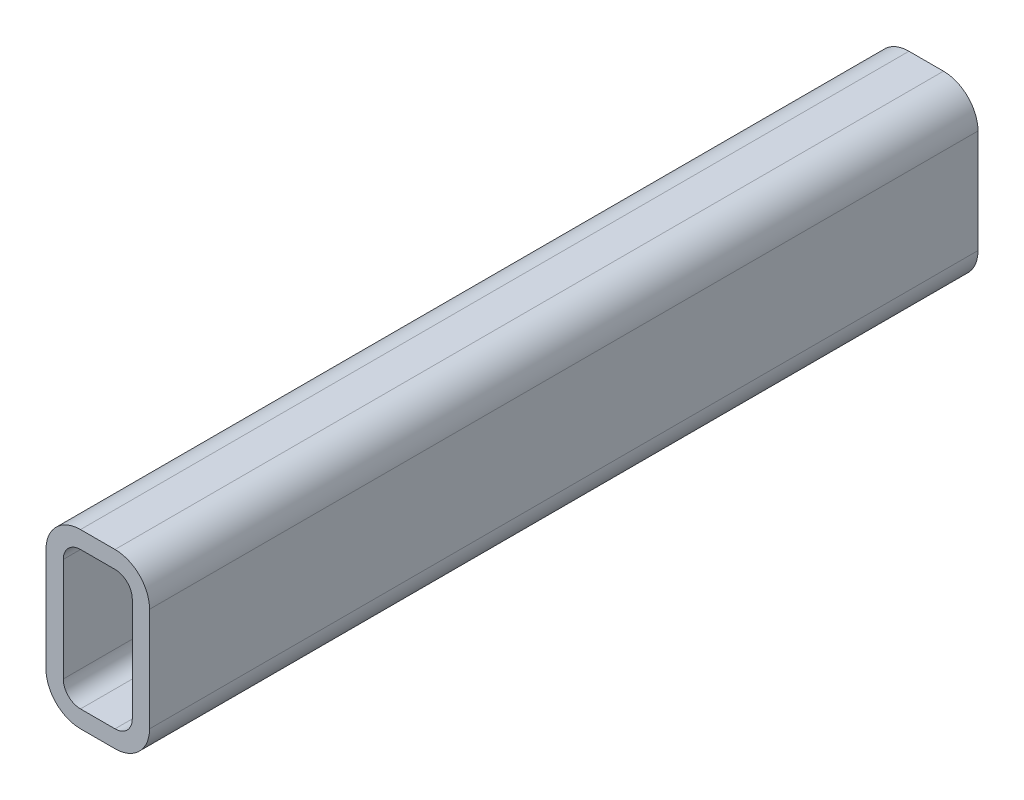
SolidWorks part; units mm, degrees
ref_plane "Front Plane" through (0, 0, 0) normal (0, 0, 1) x (1, 0, 0)
ref_plane "Top Plane" through (0, 0, 0) normal (0, 1, 0) x (1, 0, 0)
ref_plane "Right Plane" through (0, 0, 0) normal (1, 0, 0) x (0, 0, -1)
sketch "Sketch1" plane through (0, 0, 0) normal (0, 0, 1) x (1, 0, 0)
  line B0 (12.7, 63.5) -> (25.4, 63.5)
  arc B1 (38.1, 50.8) -> (25.4, 63.5) centre (25.4, 50.8) ccw
  line B2 (38.1, 50.8) -> (38.1, 12.7)
  arc B3 (25.4, 0) -> (38.1, 12.7) centre (25.4, 12.7) ccw
  line B4 (25.4, 0) -> (12.7, 0)
  arc B5 (0, 12.7) -> (12.7, 0) centre (12.7, 12.7) ccw
  line B6 (0, 12.7) -> (0, 50.8)
  arc B7 (12.7, 63.5) -> (0, 50.8) centre (12.7, 50.8) ccw
  line B8 (12.7, 57.15) -> (25.4, 57.15)
  arc B9 (31.75, 50.8) -> (25.4, 57.15) centre (25.4, 50.8) ccw
  line B10 (31.75, 50.8) -> (31.75, 12.7)
  arc B11 (25.4, 6.35) -> (31.75, 12.7) centre (25.4, 12.7) ccw
  line B12 (25.4, 6.35) -> (12.7, 6.35)
  arc B13 (6.35, 12.7) -> (12.7, 6.35) centre (12.7, 12.7) ccw
  line B14 (6.35, 12.7) -> (6.35, 50.8)
  arc B15 (12.7, 57.15) -> (6.35, 50.8) centre (12.7, 50.8) ccw
sketch_block_instance "HSS2.5x1.5x0.250-1"
sketch_block "HSS2.5x1.5x0.250"
extrude "Boss-Extrude1" add sketch "Sketch1" along normal blind 304.8
